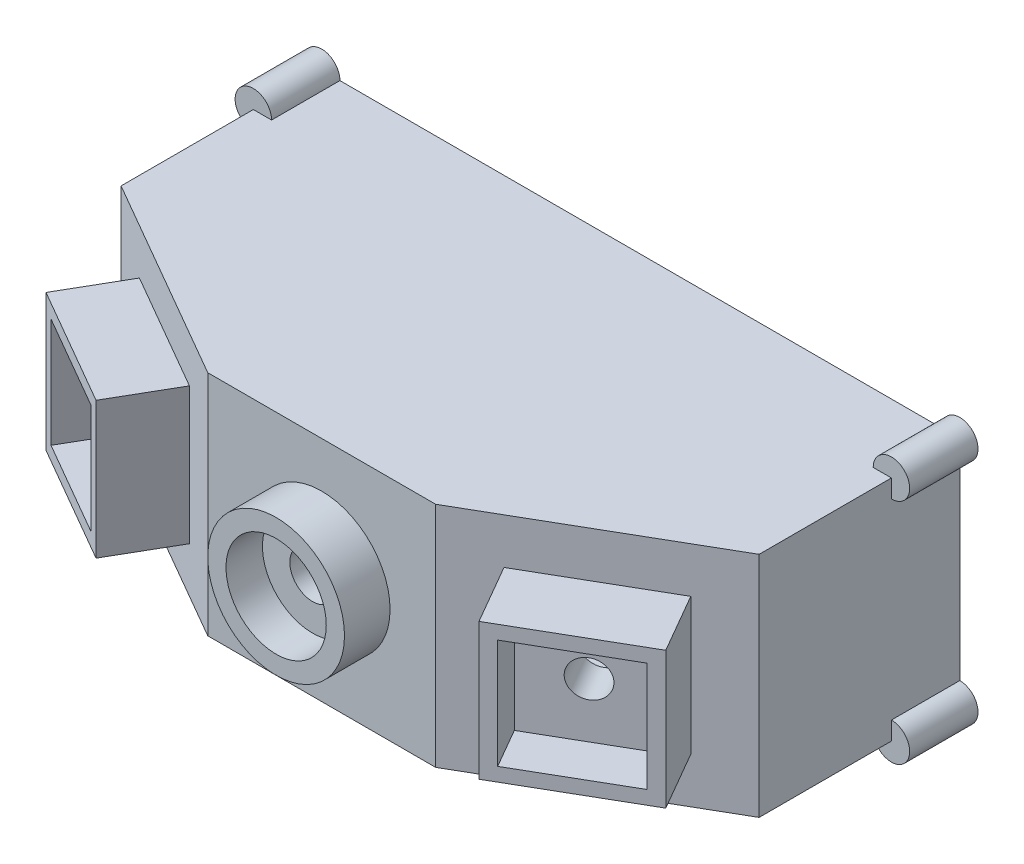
SolidWorks part; units mm, degrees
ref_plane "Alzado" through (0, 0, 0) normal (0, 0, 1) x (1, 0, 0)
ref_plane "Planta" through (0, 0, 0) normal (0, 1, 0) x (1, 0, 0)
ref_plane "Vista lateral" through (0, 0, 0) normal (1, 0, 0) x (0, 0, -1)
sketch "Croquis2" plane through (0, 0, 0) normal (0, 1, 0) x (1, 0, 0)
  line L1 (70, -35) -> (-70, -35)
  line L2 (70, -35) -> (70, 35)
  line L3 (70, 35) -> (-70, 35)
  line L4 (-70, -35) -> (-70, 35)
  line L5 (70, -35) -> (-70, 35) construction
  line L6 (70, 35) -> (-70, -35) construction
  point P0 (0, 0)
  dimension "D1" = 70
  dimension "D2" = 140
extrude "Saliente-Extruir1" add sketch "Croquis2" along normal blind 50
sketch "Croquis4" plane through (0, 50, 0) normal (0, 1, 0) x (1, 0, 0)
  line L9 (-70, -9.0192) -> (-25, -35)
  line L10 (-70, 35) -> (-70, -35) construction
  line L11 (-70, -35) -> (70, -35) construction
  line L12 (-25, -35) -> (-70, -35)
  line L13 (-70, -35) -> (-70, -9.0192)
  line L14 (70, -9.0192) -> (25, -35)
  line L15 (70, -35) -> (70, 35) construction
  line L16 (25, -35) -> (70, -35)
  line L17 (70, -35) -> (70, -9.0192)
  dimension "D1" = 50
  dimension "D2" = 30
  dimension "D3" = 30
  dimension "D4" = 45
extrude "Cortar-Extruir1" cut sketch "Croquis4" against normal blind 50
shell "Vaciado1" thickness 4
sketch "Croquis5" plane through (0, 0, 35) normal (0, 0, 1) x (1, 0, 0)
  line L0 (-25, 50) -> (25, 50) construction
  line L1 (25, 0) -> (25, 50) construction
  circle A0 centre (0, 25) radius 15
  point P6 (0, 50)
  point P9 (25, 25)
  dimension "D1" = 30
extrude "Saliente-Extruir2" add sketch "Croquis5" along normal blind 10
sketch "Croquis6" plane through (0, 0, 45) normal (0, 0, 1) x (1, 0, 0)
  circle A0 centre (0, 25) radius 11
  dimension "D1" = 22
extrude "Cortar-Extruir2" cut sketch "Croquis6" against normal blind 8
sketch "Croquis7" plane through (0, 0, 37) normal (0, 0, 1) x (1, 0, 0)
  line L0 (-25, 50) -> (25, 50) construction
  line L1 (25, 0) -> (25, 50) construction
  circle A0 centre (0, 25) radius 5
  point P4 (0, 50)
  point P7 (25, 25)
  dimension "D1" = 10
extrude "Cortar-Extruir3" cut sketch "Croquis7" against normal through all
sketch "Croquis8" plane through (-21.4054, 0, 37.0753) normal (-0.5, 0, 0.866) x (0.866, 0, 0.5)
  line L0 (-4.1506, 50) -> (-56.1122, 50) construction
  line L1 (-15.1314, 10) -> (-45.1314, 10)
  line L2 (-15.1314, 10) -> (-15.1314, 40)
  line L3 (-15.1314, 40) -> (-45.1314, 40)
  line L4 (-45.1314, 10) -> (-45.1314, 40)
  line L5 (-15.1314, 10) -> (-45.1314, 40) construction
  line L6 (-15.1314, 40) -> (-45.1314, 10) construction
  line L7 (-4.1506, 0) -> (-4.1506, 50) construction
  point P0 (-30.1314, 25)
  point P8 (-30.1314, 50)
  point P11 (-4.1506, 25)
  dimension "D1" = 30
  dimension "D2" = 30
extrude "Saliente-Extruir3" add sketch "Croquis8" along normal blind 15
sketch "Croquis9" plane through (-28.9054, 0, 50.0657) normal (-0.5, 0, 0.866) x (0.866, 0, 0.5)
  line L0 (-15.1314, 40) -> (-45.1314, 40) construction
  line L1 (-18.1314, 13) -> (-42.1314, 13)
  line L2 (-18.1314, 13) -> (-18.1314, 37)
  line L3 (-18.1314, 37) -> (-42.1314, 37)
  line L4 (-42.1314, 13) -> (-42.1314, 37)
  line L5 (-18.1314, 13) -> (-42.1314, 37) construction
  line L6 (-18.1314, 37) -> (-42.1314, 13) construction
  line L7 (-15.1314, 10) -> (-15.1314, 40) construction
  point P0 (-30.1314, 25)
  point P7 (-30.1314, 40)
  point P10 (-15.1314, 25)
  dimension "D1" = 24
  dimension "D2" = 24
extrude "Cortar-Extruir4" cut sketch "Croquis9" against normal blind 10
sketch "Croquis10" plane through (-23.9054, 0, 41.4054) normal (-0.5, 0, 0.866) x (0.866, 0, 0.5)
  circle A0 centre (-30.1314, 25) radius 4
  dimension "D1" = 8
extrude "Cortar-Extruir5" cut sketch "Croquis10" against normal blind 10
mirror "Simetría1" about plane through (0, 0, 0) normal (1, 0, 0) of "Cortar-Extruir5", "Saliente-Extruir3", "Cortar-Extruir4"
sketch "Croquis11" plane through (0, 0, 0) normal (0, -1, 0) x (1, 0, 0)
  line L0 (-7.5, 7.0096) -> (7.5, 7.0096) construction
  line L1 (-7.5, 9.5096) -> (7.5, 9.5096)
  line L2 (-7.5, 4.5096) -> (7.5, 4.5096)
  line L3 (-7.5, -2.9904) -> (7.5, -2.9904) construction
  line L4 (-7.5, -0.4904) -> (7.5, -0.4904)
  line L5 (-7.5, -5.4904) -> (7.5, -5.4904)
  line L6 (-7.5, -12.9904) -> (7.5, -12.9904) construction
  line L7 (-7.5, -10.4904) -> (7.5, -10.4904)
  line L8 (-7.5, -15.4904) -> (7.5, -15.4904)
  line L9 (70, -35) -> (-70, -35) construction
  line L10 (70, 9.0192) -> (70, -35) construction
  arc A0 (-7.5, 9.5096) -> (-7.5, 4.5096) centre (-7.5, 7.0096) ccw
  arc A1 (7.5, 4.5096) -> (7.5, 9.5096) centre (7.5, 7.0096) ccw
  arc A2 (-7.5, -0.4904) -> (-7.5, -5.4904) centre (-7.5, -2.9904) ccw
  arc A3 (7.5, -5.4904) -> (7.5, -0.4904) centre (7.5, -2.9904) ccw
  arc A4 (-7.5, -10.4904) -> (-7.5, -15.4904) centre (-7.5, -12.9904) ccw
  arc A5 (7.5, -15.4904) -> (7.5, -10.4904) centre (7.5, -12.9904) ccw
  point P2 (0, 7.0096)
  point P7 (0, -2.9904)
  point P14 (0, -12.9904)
  point P21 (-10, 7.0096)
  point P22 (10, 7.0096)
  point P23 (-10, -2.9904)
  point P24 (10, -2.9904)
  point P25 (-10, -12.9904)
  point P26 (10, -12.9904)
  point P29 (0, -35)
  point P30 (0, 9.5096)
  point P34 (70, -12.9904)
  dimension "D1" = 2.5
  dimension "D2" = 2.5
  dimension "D3" = 2.5
  dimension "D4" = 20
  dimension "D5" = 20
  dimension "D6" = 20
  dimension "D7" = 5
  dimension "D8" = 5
extrude "Cortar-Extruir6" cut sketch "Croquis11" against normal blind 10
sketch "Croquis12" plane through (0, 0, -35) normal (0, 0, -1) x (-1, 0, 0)
  circle A0 centre (70, 50) radius 4
  circle A1 centre (-70, 50) radius 4
  circle A2 centre (-70, 0) radius 4
  circle A3 centre (70, 0) radius 4
  dimension "D1" = 8
  dimension "D2" = 8
  dimension "D3" = 8
  dimension "D4" = 8
extrude "Saliente-Extruir4" add sketch "Croquis12" against normal blind 15
sketch "Croquis15" plane through (0, 0, -35) normal (0, 0, -1) x (-1, 0, 0)
  circle A0 centre (70, 50) radius 1.25
  circle A1 centre (70, 0) radius 1.25
  circle A2 centre (-70, 0) radius 1.25
  circle A3 centre (-70, 50) radius 1.25
  dimension "D1" = 2.5
  dimension "D2" = 2.5
  dimension "D3" = 2.5
  dimension "D4" = 2.5
extrude "Cortar-Extruir7" cut sketch "Croquis15" against normal blind 10
